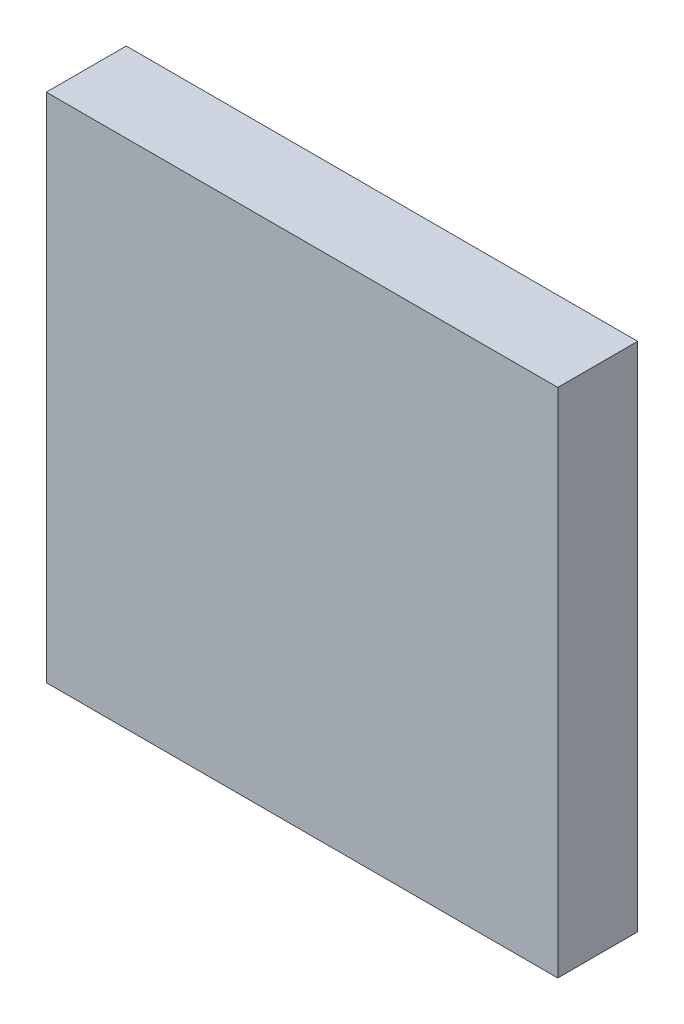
SolidWorks part; units mm, degrees
ref_plane "Front Plane" through (0, 0, 0) normal (0, 0, 1) x (1, 0, 0)
ref_plane "Top Plane" through (0, 0, 0) normal (0, 1, 0) x (1, 0, 0)
ref_plane "Right Plane" through (0, 0, 0) normal (1, 0, 0) x (0, 0, -1)
sketch "Sketch1" plane through (0, 0, 0) normal (0, 0, 1) x (1, 0, 0)
  line L1 (0, 0) -> (80, 0)
  line L2 (0, 0) -> (0, 80)
  line L3 (0, 80) -> (80, 80)
  line L4 (80, 0) -> (80, 80)
  dimension "D1" = 80
  dimension "D2" = 80
extrude "Extrude1" add sketch "Sketch1" along normal blind 12.5
